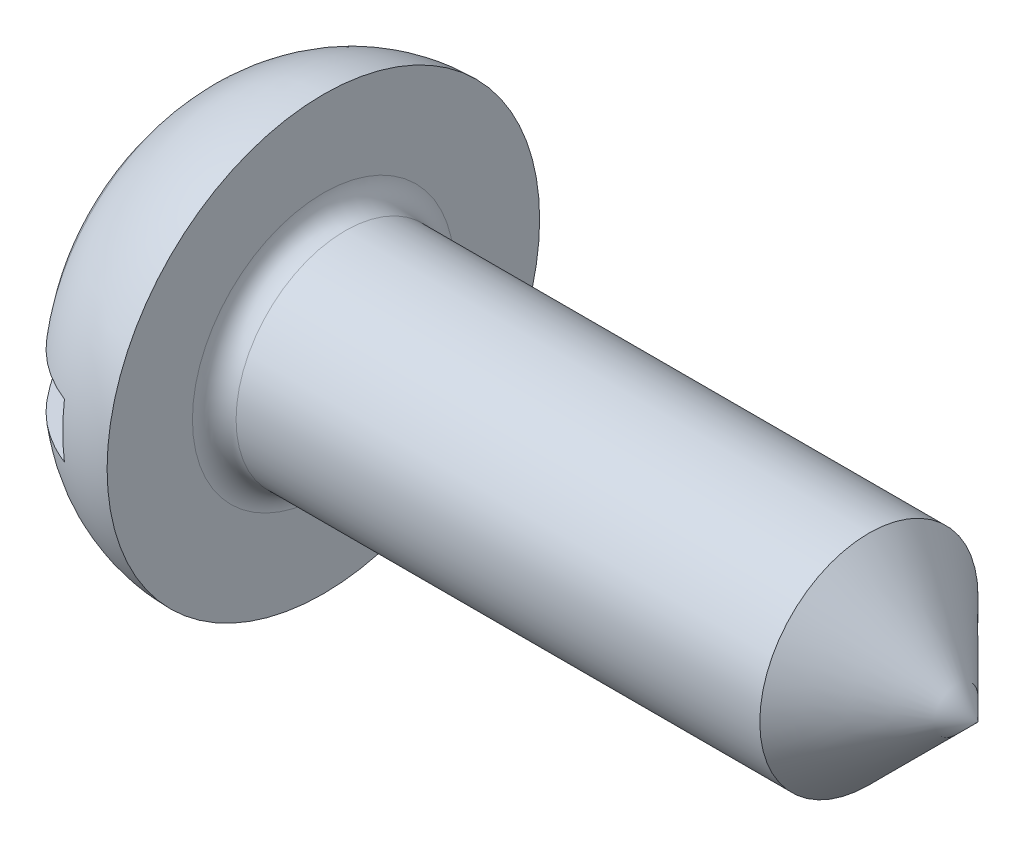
SolidWorks part; units mm, degrees
ref_plane "Front" through (0, 0, 0) normal (0, 0, 1) x (1, 0, 0)
ref_plane "Top" through (0, 0, 0) normal (0, 1, 0) x (1, 0, 0)
ref_plane "Right" through (0, 0, 0) normal (1, 0, 0) x (0, 0, -1)
sketch "Sketch2" plane through (2.3892, 0, -0.4071) normal (0, 1, 0) x (0, 0, -1)
  line L0 (-0.4071, 0.7892) -> (-0.4071, 1.2892)
  line L2 (-0.4071, 1.2892) -> (-0.1571, 1.2892)
  line L3 (-0.1571, 1.2892) -> (-0.1571, 2.3892)
  line L4 (-0.4071, 0.7892) -> (1.5751, 0.7892)
  line L5 (-0.4071, -1.008) -> (-0.4071, 3.8043) construction
  arc A0 (-0.1571, 2.3892) -> (1.0806, 1.8569) centre (-0.4071, 0.1029) cw
  arc A1 (1.5751, 0.7892) -> (1.0806, 1.8569) centre (0.1751, 0.7892) ccw
  dimension "r1" = 2.3
  dimension "r2" = 1.4
  dimension "t" = 1.1
  dimension "n" = 0.5
  dimension "k" = 1.6
revolve "BaseHead" add sketch "Sketch2" angle 360 about L5
sketch "Sketch1" plane through (1.6, 0.5923, -0.1734) normal (1, 0, 0) x (0, 0, -1)
  circle A0 centre (-0.1734, -0.5923) radius 1
  circle A1 centre (-0.1734, -0.5923) radius 1.9821 construction
  dimension "d" = 2
extrude "BaseBody" add sketch "Sketch1" along normal blind 6
sketch "Sketch3" plane through (1.1978, 1.1978, 0) normal (0, 0, 1) x (0, 1, 0)
  line L0 (-0.9478, 0.0978) -> (-0.9478, 1.1978) construction
  line L1 (-0.9478, 0.0978) -> (-0.9478, 1.1978)
  line L2 (-1.4478, 1.1978) -> (-1.4478, 0.0978) construction
  line L3 (-1.4478, 1.1978) -> (-1.4478, 0.0978)
  line L4 (-1.1978, 0.0526) -> (-1.1978, 2.3431) construction
  line L5 (-1.4478, 1.1978) -> (-0.9478, 1.1978)
  line L6 (-1.4478, 0.0978) -> (-0.9478, 0.0978)
extrude "Slot" cut sketch "Sketch3" against normal through all and the other way through all
sketch "Sketch4" plane through (23.2633, -6.7367, 0) normal (0, 0, 1) x (0, 1, 0)
  line L0 (6.7367, 17.6285) -> (6.7367, 14.19) construction
  line L1 (7.7367, 15.6633) -> (7.7367, 21.6633) construction
  line L3 (8.7367, 14.6633) -> (8.7367, 17.6633)
  line L4 (8.7367, 17.6633) -> (6.7367, 15.6633)
  line L5 (6.7367, 15.6633) -> (6.7367, 14.6633)
  line L6 (6.7367, 14.6633) -> (8.7367, 14.6633)
  line L7 (5.7367, 15.6633) -> (7.7367, 15.6633) construction
  dimension "D1" = 1
  dimension "D2" = 45
  dimension "D3" = 1
revolve "Cut-Revolve1" cut sketch "Sketch4" angle 360 about L0
fillet "Fillet1" radius 0.2 1 edges at (1.6, 0, -1)
sketch "Sketch5" plane through (0, 0, 0) normal (0, 0, 1) x (1, 0, 0)
  line L0 (3.6, 1.2) -> (3.85, 1.2)
  line L1 (3.85, 1.2) -> (3.85, 1)
  line L2 (3.85, 1) -> (3.725, 0.7835)
  line L3 (3.6, 1) -> (3.725, 0.7835)
  line L4 (3.6, 1.2) -> (3.6, 1)
  line L5 (21.5487, 0) -> (0, 0) construction
  line L6 (3.6, 1) -> (3.85, 1) construction
  line L7 (3.725, 1) -> (3.725, 0.7835) construction
  line L8 (6.6, 1) -> (1.8, 1) construction
  point P6 (3.725, 1.2)
  dimension "D1" = 0.2
  dimension "D2" = 0.25
  dimension "D3" = 4
revolve "Cut-Revolve10" [suppressed] cut sketch "Sketch5" angle 360 about L5
pattern_linear "LPattern10" [suppressed] count 8 spacing 0.5
equation "\"D3@Sketch5\" = \"D1@ThreadCosmetic1\" + \"d@Sketch1\" / 2"
equation "\"D2@Sketch5\" = (  \"d@Sketch1\" - \"D2@ThreadCosmetic1\" )  / 2"
equation "\"D3@LPattern10\" = \"D2@Sketch5\" * 2"
equation "\"D1@LPattern10\" = \"D3@Sketch5\" / \"D3@LPattern10\""
